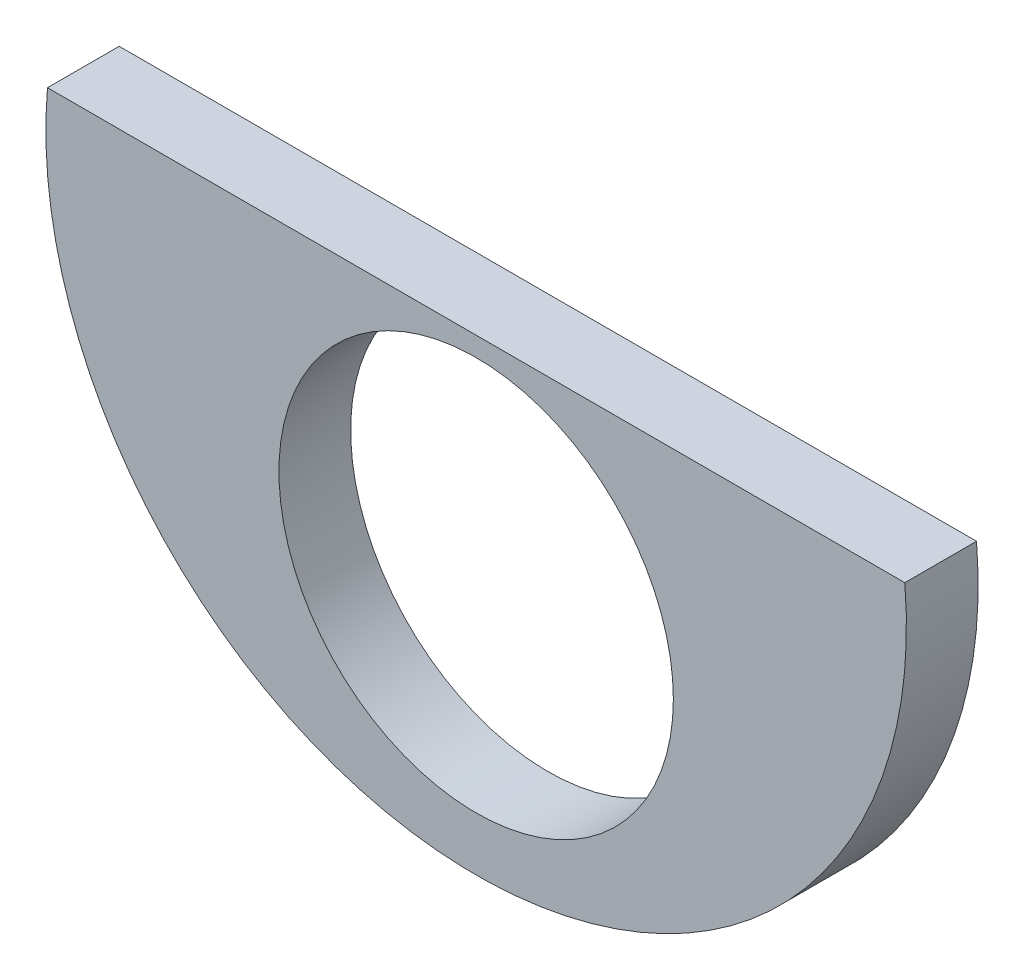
SolidWorks part; units mm, degrees
ref_plane "Front Plane" through (0, 0, 0) normal (0, 0, 1) x (1, 0, 0)
ref_plane "Top Plane" through (0, 0, 0) normal (0, 1, 0) x (1, 0, 0)
ref_plane "Right Plane" through (0, 0, 0) normal (1, 0, 0) x (0, 0, -1)
sketch "Sketch1" plane through (0, 0, 0) normal (0, 0, 1) x (1, 0, 0)
  line L0 (-18.9783, 1.651) -> (18.9783, 1.651)
  arc A1 (18.9783, 1.651) -> (-18.9783, 1.651) centre (0, 0) cw
extrude "Extrude1" add sketch "Sketch1" along normal blind 3.175
sketch "Sketch4" plane through (0, 0, 3.175) normal (0, 0, 1) x (1, 0, 0)
  line L0 (-20.5726, -7.9375) -> (18.4599, -7.9375) construction
  line L1 (0, -19.05) -> (15.7321, -19.05) construction
  arc A0 (-18.9783, 1.651) -> (18.9783, 1.651) centre (0, 0) ccw construction
  circle A1 centre (0, -7.9375) radius 8.7312
  dimension "D1" = 11.1125
extrude "Cut-Extrude3" cut sketch "Sketch4" against normal blind 3.175
